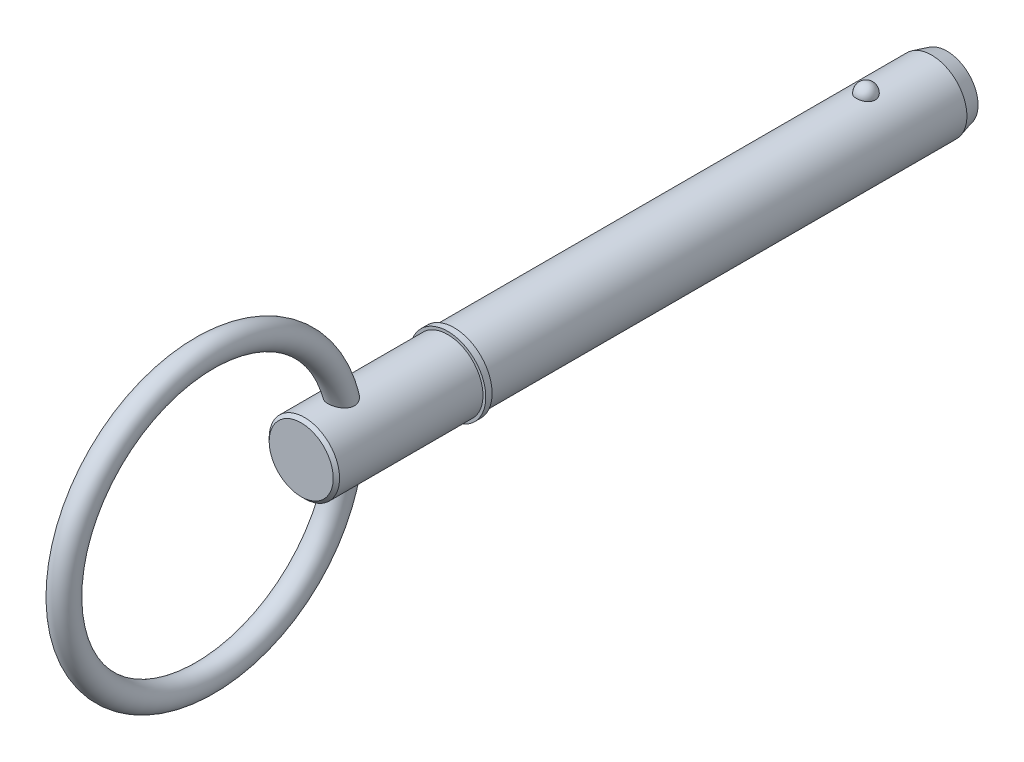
SolidWorks part; units mm, degrees
ref_plane "Front Plane" through (0, 0, 0) normal (0, 0, 1) x (1, 0, 0)
ref_plane "Top Plane" through (0, 0, 0) normal (0, 1, 0) x (1, 0, 0)
ref_plane "Right Plane" through (0, 0, 0) normal (1, 0, 0) x (0, 0, -1)
sketch "Sketch2" plane through (0, 0, 0) normal (0, 0, 1) x (1, 0, 0)
  circle A0 centre (0, 0) radius 5.555
  point P3 (0, 5.555)
  dimension "D1" = 11.11
extrude "Boss-Extrude1" add sketch "Sketch2" along normal blind 63.5
sketch "Sketch3" plane through (0, 0, 0) normal (0, 0, -1) x (-1, 0, 0)
  circle A0 centre (0, 0) radius 5.555
  dimension "D1" = 11.11
extrude "Boss-Extrude2" add sketch "Sketch3" along normal blind 14.27
chamfer "Chamfer1" distance 2.4 angle 15 1 edges at (-5.555, 0, -14.27)
sketch "Sketch18" plane through (0, 0, 0) normal (1, 0, 0) x (0, 0, -1)
  line L0 (11.87, 5.555) -> (-63.5, 5.555) construction
  line L1 (1.49, 7.045) -> (1.49, 4.065)
  line L2 (-63.5, -5.555) -> (11.87, -5.555) construction
  arc A0 (1.49, 7.045) -> (1.49, 4.065) centre (1.49, 5.555) ccw
  point P4 (0, 5.555)
  dimension "D1" = 12.6
revolve "Revolve1" add sketch "Sketch18" angle 360 about L1
sketch "Sketch19" plane through (0, 0, 0) normal (1, 0, 0) x (0, 0, -1)
  line L0 (-33.7288, 0) -> (-46.4542, 0) construction
sketch "Sketch20" plane through (0, 0, 0) normal (1, 0, 0) x (0, 0, -1)
  line L0 (-63.5, 0) -> (-63.5, 6)
  line L1 (-63.5, 5.555) -> (-63.5, -5.555) construction
  line L2 (-63.5, 6) -> (-64.5, 6)
  line L3 (-64.5, 6) -> (-64.5, 0)
  line L4 (-33.7288, 0) -> (-46.4542, 0) construction
  line L5 (-64.5, 0) -> (-63.5, 0)
  dimension "D1" = 6
  dimension "D2" = 1
revolve "Revolve2" add sketch "Sketch20" angle 360 about L0
sketch "Sketch21" plane through (0, 0, 63.5) normal (0, 0, -1) x (-1, 0, 0)
  circle A0 centre (0, 0) radius 5.555
  dimension "D1" = 11.11
extrude "Boss-Extrude3" add sketch "Sketch21" against normal blind 24.13
chamfer "Chamfer2" distance 0.5 angle 45 1 edges at (-5.555, 0, 87.63)
sketch "Sketch23" plane through (0, 0, 0) normal (1, 0, 0) x (0, 0, -1)
  line L0 (-87.63, 5.055) -> (-87.63, -5.055) construction
  circle A0 centre (-102.855, 0) radius 22.225
  point P2 (-80.63, 0)
  dimension "D1" = 44.45
  dimension "D2" = 7
sketch "Sketch24" plane through (0, 0, 0) normal (0, 1, 0) x (1, 0, 0)
  circle A0 centre (0, -80.63) radius 2
  dimension "D1" = 4
sweep "Sweep1" add profiles "Sketch24" path "Sketch23"
